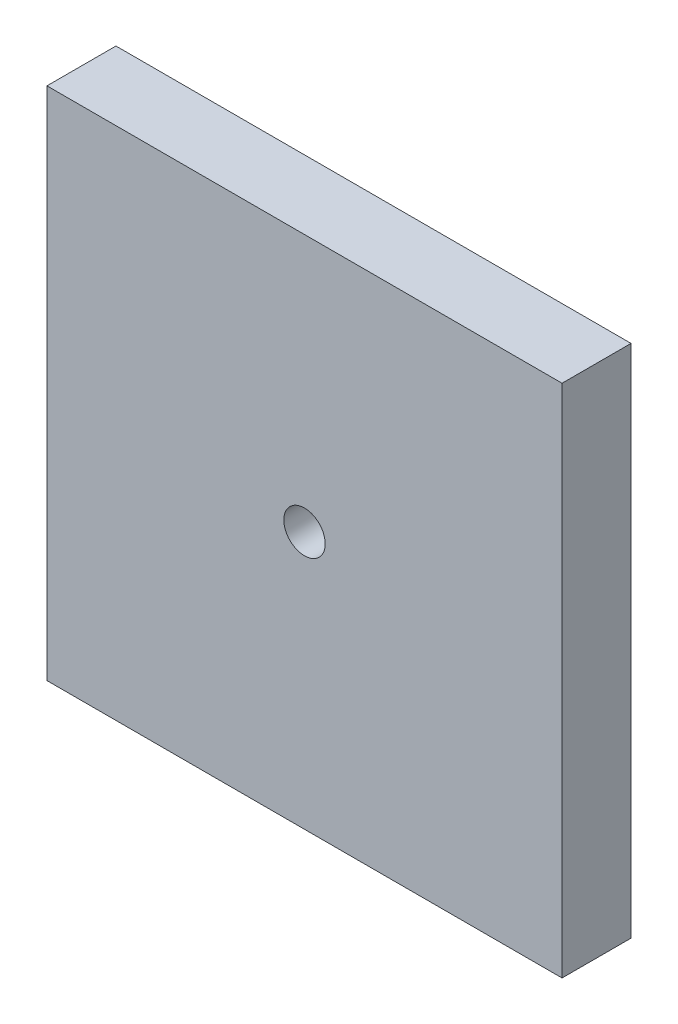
SolidWorks part; units mm, degrees
ref_plane "Front Plane" through (0, 0, 0) normal (0, 0, 1) x (1, 0, 0)
ref_plane "Top Plane" through (0, 0, 0) normal (0, 1, 0) x (1, 0, 0)
ref_plane "Right Plane" through (0, 0, 0) normal (1, 0, 0) x (0, 0, -1)
sketch "Sketch1" plane through (0, 0, 0) normal (0, 0, 1) x (1, 0, 0)
  line L1 (-44.45, -44.45) -> (44.45, -44.45)
  line L2 (-44.45, -44.45) -> (-44.45, 44.45)
  line L3 (-44.45, 44.45) -> (44.45, 44.45)
  line L4 (44.45, -44.45) -> (44.45, 44.45)
  line L5 (-44.45, -44.45) -> (44.45, 44.45) construction
  line L6 (-44.45, 44.45) -> (44.45, -44.45) construction
  point P0 (0, 0)
  dimension "D1" = 88.9
  dimension "D2" = 88.9
extrude "Boss-Extrude1" add sketch "Sketch1" along normal blind 11.9062
sketch "Sketch2" plane through (0, 0, 11.9062) normal (0, 0, 1) x (1, 0, 0)
  point P0 (0, 0)
hole_wizard "9/32 (0.28125) Diameter Hole1" positions "Sketch3" profile "Sketch4" hole size "9/32" standard "ANSI Inch"
sketch "Sketch3" plane through (0, 0, 11.9062) normal (0, 0, 1) x (1, 0, 0)
  point P0 (0, 0)
sketch "Sketch4" plane through (0, 0, 11.9062) normal (1, 0, 0) x (0, -1, 0)
  line L0 (0, 0) -> (0, 11.9062)
  line L1 (0, 11.9062) -> (3.5719, 11.9062)
  line L2 (3.5719, 11.9062) -> (3.5719, 0)
  line L5 (3.5719, 0) -> (0, 0)
  line L11 (0, -6.35) -> (0, 107.95) construction
  dimension "Thru Hole Dia." = 7.1437
  dimension "Thru Hole Depth" = 11.9062
